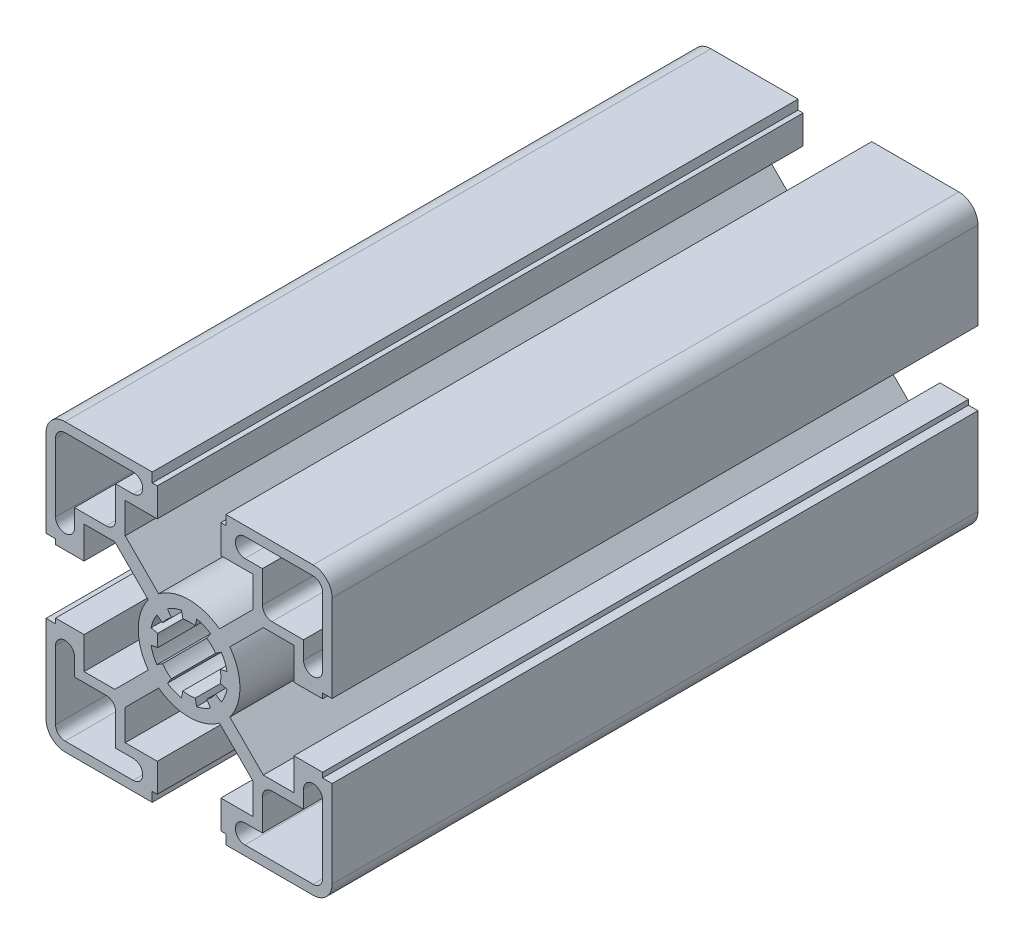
SolidWorks part; units mm, degrees
ref_plane "Front Plane" through (0, 0, 0) normal (0, 0, 1) x (1, 0, 0)
ref_plane "Top Plane" through (0, 0, 0) normal (0, 1, 0) x (1, 0, 0)
ref_plane "Right Plane" through (0, 0, 0) normal (1, 0, 0) x (0, 0, -1)
sketch "Sketch1" plane through (0, 0, 0) normal (0, 0, 1) x (1, 0, 0)
  line L2 (-19.5072, 22.5044) -> (-5.7912, 22.5044)
  line L3 (-5.7912, 22.5044) -> (-5.7912, 21.0058)
  line L4 (-5.7912, 21.0058) -> (-5.0038, 21.0058)
  line L6 (-5.0038, 21.0058) -> (-5.0038, 16.51)
  line L7 (-5.0038, 16.51) -> (-10.0457, 16.51)
  line L8 (-10.0457, 16.51) -> (-10.0457, 11.6801)
  line L9 (-10.0457, 11.6801) -> (-4.781, 6.4154)
  line L11 (-11.6801, 10.0457) -> (-6.4154, 4.781)
  line L12 (-16.51, 10.0457) -> (-11.6801, 10.0457)
  line L13 (-16.51, 5.0038) -> (-16.51, 10.0457)
  line L14 (-21.0058, 5.0038) -> (-16.51, 5.0038)
  line L15 (-21.0058, 5.7912) -> (-21.0058, 5.0038)
  line L16 (-22.5044, 5.7912) -> (-21.0058, 5.7912)
  line L17 (-22.5044, 19.5072) -> (-22.5044, 5.7912)
  line L18 (-18.0086, 11.5443) -> (-13.0429, 11.5443)
  line L19 (-18.0086, 11.5443) -> (-18.0086, 8.7884)
  line L20 (-11.5443, 18.0086) -> (-11.5443, 13.0429)
  line L21 (-21.0058, 19.5072) -> (-21.0058, 8.7884)
  line L23 (-11.5443, 18.0086) -> (-8.7884, 18.0086)
  line L24 (-19.5072, 21.0058) -> (-8.7884, 21.0058)
  line L25 (1.1893, 5.9789) -> (0.9762, 4.9077)
  line L26 (-1.1893, 5.9789) -> (-0.9762, 4.9077)
  line L27 (5.0686, 3.3868) -> (4.1605, 2.78)
  line L28 (3.3868, 5.0686) -> (2.78, 4.1605)
  line L29 (5.9789, -1.1893) -> (4.9077, -0.9762)
  line L30 (5.9789, 1.1893) -> (4.9077, 0.9762)
  line L31 (3.3868, -5.0686) -> (2.78, -4.1605)
  line L32 (5.0686, -3.3868) -> (4.1605, -2.78)
  line L33 (-1.1893, -5.9789) -> (-0.9762, -4.9077)
  line L34 (1.1893, -5.9789) -> (0.9762, -4.9077)
  line L35 (-5.0686, -3.3868) -> (-4.1605, -2.78)
  line L36 (-3.3868, -5.0686) -> (-2.78, -4.1605)
  line L37 (-5.9789, 1.1893) -> (-4.9077, 0.9762)
  line L38 (-5.9789, -1.1893) -> (-4.9077, -0.9762)
  line L39 (-3.3868, 5.0686) -> (-2.78, 4.1605)
  line L40 (-5.0686, 3.3868) -> (-4.1605, 2.78)
  line L41 (11.5443, 18.0086) -> (8.7884, 18.0086)
  line L42 (19.5072, 21.0058) -> (8.7884, 21.0058)
  line L43 (19.5072, 22.5044) -> (5.7912, 22.5044)
  line L44 (5.7912, 22.5044) -> (5.7912, 21.0058)
  line L45 (5.7912, 21.0058) -> (5.0038, 21.0058)
  line L46 (5.0038, 21.0058) -> (5.0038, 16.51)
  line L47 (5.0038, 16.51) -> (10.0457, 16.51)
  line L48 (10.0457, 16.51) -> (10.0457, 11.6801)
  line L49 (10.0457, 11.6801) -> (4.781, 6.4154)
  line L50 (11.6801, 10.0457) -> (6.4154, 4.781)
  line L51 (21.0058, 19.5072) -> (21.0058, 8.7884)
  line L52 (11.5443, 18.0086) -> (11.5443, 13.0429)
  line L53 (18.0086, 11.5443) -> (18.0086, 8.7884)
  line L54 (18.0086, 11.5443) -> (13.0429, 11.5443)
  line L55 (22.5044, 19.5072) -> (22.5044, 5.7912)
  line L56 (22.5044, 5.7912) -> (21.0058, 5.7912)
  line L57 (21.0058, 5.7912) -> (21.0058, 5.0038)
  line L58 (21.0058, 5.0038) -> (16.51, 5.0038)
  line L59 (16.51, 5.0038) -> (16.51, 10.0457)
  line L60 (16.51, 10.0457) -> (11.6801, 10.0457)
  line L61 (16.51, -10.0457) -> (11.6801, -10.0457)
  line L62 (16.51, -5.0038) -> (16.51, -10.0457)
  line L63 (21.0058, -5.0038) -> (16.51, -5.0038)
  line L64 (21.0058, -5.7912) -> (21.0058, -5.0038)
  line L65 (22.5044, -5.7912) -> (21.0058, -5.7912)
  line L66 (22.5044, -19.5072) -> (22.5044, -5.7912)
  line L67 (18.0086, -11.5443) -> (13.0429, -11.5443)
  line L68 (18.0086, -11.5443) -> (18.0086, -8.7884)
  line L69 (11.5443, -18.0086) -> (11.5443, -13.0429)
  line L70 (21.0058, -19.5072) -> (21.0058, -8.7884)
  line L71 (11.6801, -10.0457) -> (6.4154, -4.781)
  line L72 (10.0457, -11.6801) -> (4.781, -6.4154)
  line L73 (10.0457, -16.51) -> (10.0457, -11.6801)
  line L74 (5.0038, -16.51) -> (10.0457, -16.51)
  line L75 (5.0038, -21.0058) -> (5.0038, -16.51)
  line L76 (5.7912, -21.0058) -> (5.0038, -21.0058)
  line L77 (5.7912, -22.5044) -> (5.7912, -21.0058)
  line L78 (19.5072, -22.5044) -> (5.7912, -22.5044)
  line L79 (19.5072, -21.0058) -> (8.7884, -21.0058)
  line L80 (11.5443, -18.0086) -> (8.7884, -18.0086)
  line L81 (-11.5443, -18.0086) -> (-8.7884, -18.0086)
  line L82 (-19.5072, -21.0058) -> (-8.7884, -21.0058)
  line L83 (-19.5072, -22.5044) -> (-5.7912, -22.5044)
  line L84 (-5.7912, -22.5044) -> (-5.7912, -21.0058)
  line L85 (-5.7912, -21.0058) -> (-5.0038, -21.0058)
  line L86 (-5.0038, -21.0058) -> (-5.0038, -16.51)
  line L87 (-5.0038, -16.51) -> (-10.0457, -16.51)
  line L88 (-10.0457, -16.51) -> (-10.0457, -11.6801)
  line L89 (-10.0457, -11.6801) -> (-4.781, -6.4154)
  line L90 (-11.6801, -10.0457) -> (-6.4154, -4.781)
  line L91 (-21.0058, -19.5072) -> (-21.0058, -8.7884)
  line L92 (-11.5443, -18.0086) -> (-11.5443, -13.0429)
  line L93 (-18.0086, -11.5443) -> (-18.0086, -8.7884)
  line L94 (-18.0086, -11.5443) -> (-13.0429, -11.5443)
  line L95 (-22.5044, -19.5072) -> (-22.5044, -5.7912)
  line L96 (-22.5044, -5.7912) -> (-21.0058, -5.7912)
  line L97 (-21.0058, -5.7912) -> (-21.0058, -5.0038)
  line L98 (-21.0058, -5.0038) -> (-16.51, -5.0038)
  line L99 (-16.51, -5.0038) -> (-16.51, -10.0457)
  line L100 (-16.51, -10.0457) -> (-11.6801, -10.0457)
  arc A0 (-22.5044, 19.5072) -> (-19.5072, 22.5044) centre (-19.5072, 19.5072) cw
  arc A1 (-21.0058, 8.7884) -> (-18.0086, 8.7884) centre (-19.5072, 8.7884) ccw
  arc A2 (-21.0058, 19.5072) -> (-19.5072, 21.0058) centre (-19.5072, 19.5072) cw
  arc A3 (-8.7884, 21.0058) -> (-8.7884, 18.0086) centre (-8.7884, 19.5072) cw
  arc A4 (-11.5443, 13.0429) -> (-13.0429, 11.5443) centre (-13.0429, 13.0429) cw
  arc A5 (6.4154, -4.781) -> (6.4154, 4.781) centre (0, 0) ccw
  arc A6 (0.9762, 4.9077) -> (-0.9762, 4.9077) centre (0, 0) ccw
  arc A7 (-5.0686, 3.3868) -> (-5.9789, 1.1893) centre (0, 0) ccw
  arc A8 (4.1605, 2.78) -> (2.78, 4.1605) centre (0, 0) ccw
  arc A9 (4.9077, -0.9762) -> (4.9077, 0.9762) centre (0, 0) ccw
  arc A10 (2.78, -4.1605) -> (4.1605, -2.78) centre (0, 0) ccw
  arc A11 (-0.9762, -4.9077) -> (0.9762, -4.9077) centre (0, 0) ccw
  arc A12 (-4.1605, -2.78) -> (-2.78, -4.1605) centre (0, 0) ccw
  arc A13 (-4.9077, 0.9762) -> (-4.9077, -0.9762) centre (0, 0) ccw
  arc A14 (-2.78, 4.1605) -> (-4.1605, 2.78) centre (0, 0) ccw
  arc A15 (-5.9789, -1.1893) -> (-5.0686, -3.3868) centre (0, 0) ccw
  arc A16 (-3.3868, -5.0686) -> (-1.1893, -5.9789) centre (0, 0) ccw
  arc A17 (1.1893, -5.9789) -> (3.3868, -5.0686) centre (0, 0) ccw
  arc A18 (5.0686, -3.3868) -> (5.9789, -1.1893) centre (0, 0) ccw
  arc A19 (5.9789, 1.1893) -> (5.0686, 3.3868) centre (0, 0) ccw
  arc A20 (3.3868, 5.0686) -> (1.1893, 5.9789) centre (0, 0) ccw
  arc A21 (-1.1893, 5.9789) -> (-3.3868, 5.0686) centre (0, 0) ccw
  arc A22 (8.7884, 21.0058) -> (8.7884, 18.0086) centre (8.7884, 19.5072) ccw
  arc A23 (21.0058, 19.5072) -> (19.5072, 21.0058) centre (19.5072, 19.5072) ccw
  arc A24 (22.5044, 19.5072) -> (19.5072, 22.5044) centre (19.5072, 19.5072) ccw
  arc A25 (11.5443, 13.0429) -> (13.0429, 11.5443) centre (13.0429, 13.0429) ccw
  arc A26 (21.0058, 8.7884) -> (18.0086, 8.7884) centre (19.5072, 8.7884) cw
  arc A27 (21.0058, -8.7884) -> (18.0086, -8.7884) centre (19.5072, -8.7884) ccw
  arc A28 (11.5443, -13.0429) -> (13.0429, -11.5443) centre (13.0429, -13.0429) cw
  arc A29 (22.5044, -19.5072) -> (19.5072, -22.5044) centre (19.5072, -19.5072) cw
  arc A30 (21.0058, -19.5072) -> (19.5072, -21.0058) centre (19.5072, -19.5072) cw
  arc A31 (8.7884, -21.0058) -> (8.7884, -18.0086) centre (8.7884, -19.5072) cw
  arc A32 (-8.7884, -21.0058) -> (-8.7884, -18.0086) centre (-8.7884, -19.5072) ccw
  arc A33 (-21.0058, -19.5072) -> (-19.5072, -21.0058) centre (-19.5072, -19.5072) ccw
  arc A34 (-22.5044, -19.5072) -> (-19.5072, -22.5044) centre (-19.5072, -19.5072) ccw
  arc A35 (-11.5443, -13.0429) -> (-13.0429, -11.5443) centre (-13.0429, -13.0429) ccw
  arc A36 (-21.0058, -8.7884) -> (-18.0086, -8.7884) centre (-19.5072, -8.7884) cw
  arc A37 (4.781, 6.4154) -> (-4.781, 6.4154) centre (0, 0) ccw
  arc A38 (-4.781, -6.4154) -> (4.781, -6.4154) centre (0, 0) ccw
  arc A39 (-6.4154, 4.781) -> (-6.4154, -4.781) centre (0, 0) ccw
extrude "Boss-Extrude1" add sketch "Sketch1" along normal mid plane 101.6
